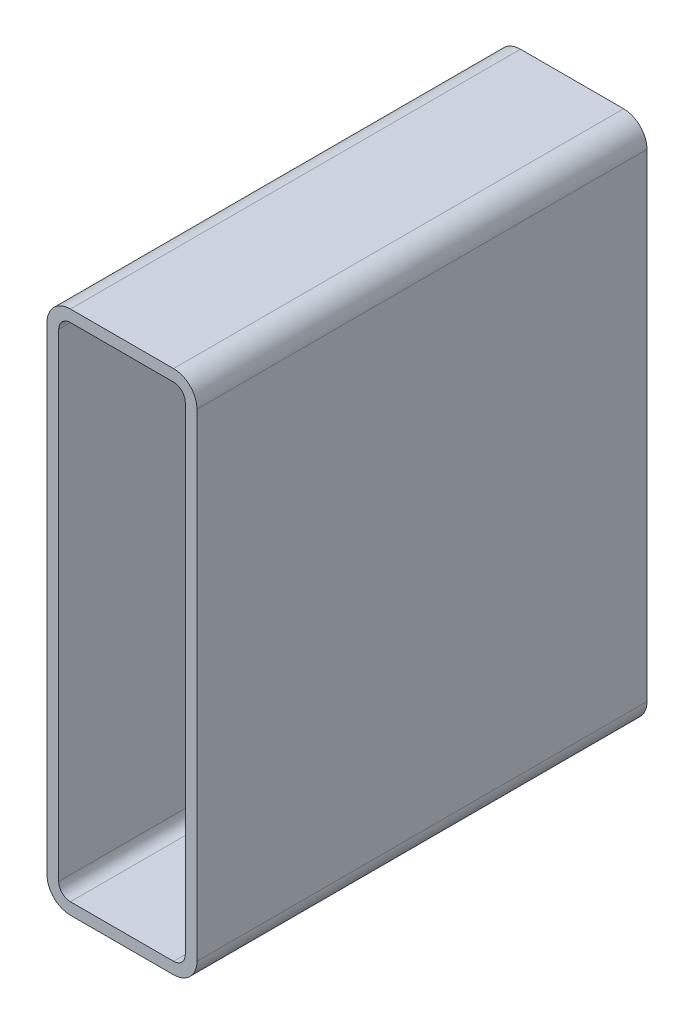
SolidWorks part; units mm, degrees
ref_plane "Front Plane" through (0, 0, 0) normal (0, 0, 1) x (1, 0, 0)
ref_plane "Top Plane" through (0, 0, 0) normal (0, 1, 0) x (1, 0, 0)
ref_plane "Right Plane" through (0, 0, 0) normal (1, 0, 0) x (0, 0, -1)
sketch "Sketch1" plane through (0, 0, 0) normal (0, 0, 1) x (1, 0, 0)
sketch_block_instance "HSS14x4x0.3125-1"
sketch_block "HSS14x4x0.3125"
extrude "Boss-Extrude1" add sketch "Sketch1" along normal blind 304.8
